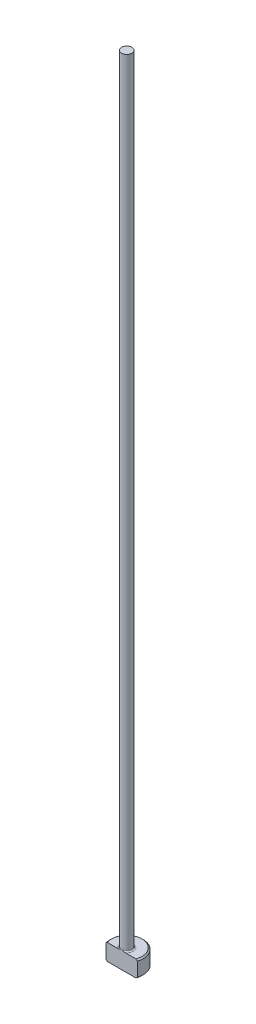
SolidWorks part; units mm, degrees
ref_plane "Front Plane" through (0, 0, 0) normal (0, 0, 1) x (1, 0, 0)
ref_plane "Top Plane" through (0, 0, 0) normal (0, 1, 0) x (1, 0, 0)
ref_plane "Right Plane" through (0, 0, 0) normal (1, 0, 0) x (0, 0, -1)
sketch "Sketch1" plane through (0, 0, 0) normal (0, 0, 1) x (1, 0, 0)
  line L0 (0, 259.9588) -> (0, -15.1925) construction
  line L1 (0, 0) -> (-3.175, 0)
  line L2 (-3.175, 0) -> (-3.175, 3.175)
  line L3 (-3.175, 3.175) -> (-0.9919, 3.175)
  line L4 (-0.9919, 3.175) -> (-0.9919, 152.4)
  line L5 (-0.9919, 152.4) -> (0, 152.4)
  line L6 (0, 152.4) -> (0, 0)
  dimension "L" = 152.4
  dimension "H" = 6.35
  dimension "T" = 3.175
  dimension "D" = 1.9837
revolve "Revolve1" add sketch "Sketch1" angle 360 about L0
chamfer "Chamfer1" distance 0.254 angle 45 2 edges at (0, 3.175, 3.175) (0, 0, 3.175)
fillet "Fillet1" radius 0.254 1 edges at (0, 3.175, 0.9919)
sketch "Sketch2" plane through (0, 0, 0) normal (0, 1, 0) x (1, 0, 0)
  line L0 (-3.0161, -0.9919) -> (3.0161, -0.9919)
  circle A0 centre (0, 0) radius 3.175 construction
  arc A1 (-3.0161, -0.9919) -> (3.0161, -0.9919) centre (0, 0) ccw
  circle A3 centre (0, 0) radius 0.9919 construction
  dimension "D1" = 0
extrude "Key" cut sketch "Sketch2" along normal through all
sketch "Pocket Sketch" plane through (0, 0, 0) normal (0, 0, 1) x (1, 0, 0)
  line L0 (-3.5719, 0) -> (-3.5719, 3.2004)
  line L1 (-3.5719, 3.2004) -> (-1.9523, 3.2004)
  line L2 (-1.1903, 3.9624) -> (-1.1903, 22.225)
  line L3 (-1.1903, 22.225) -> (0, 22.225)
  line L4 (0, 22.225) -> (0, 0)
  line L5 (0, 0) -> (-3.5719, 0)
  line L6 (0, 12.6104) -> (0, -2.4989) construction
  line L7 (-3.175, 2.921) -> (-3.175, 0.254) construction
  line L8 (2.921, 3.175) -> (-2.921, 3.175) construction
  line L9 (-0.9919, 152.4) -> (-0.9919, 3.429) construction
  line L10 (-1.9523, 3.2004) -> (-1.1903, 3.9624)
  point P3 (-1.1903, 3.2004)
  dimension "D1" = 7.1437
  dimension "D2" = 0.3969
  dimension "D3" = 0.0254
  dimension "D4" = 0.1984
  dimension "D5" = 2.3806
  dimension "D6" = 22.225
